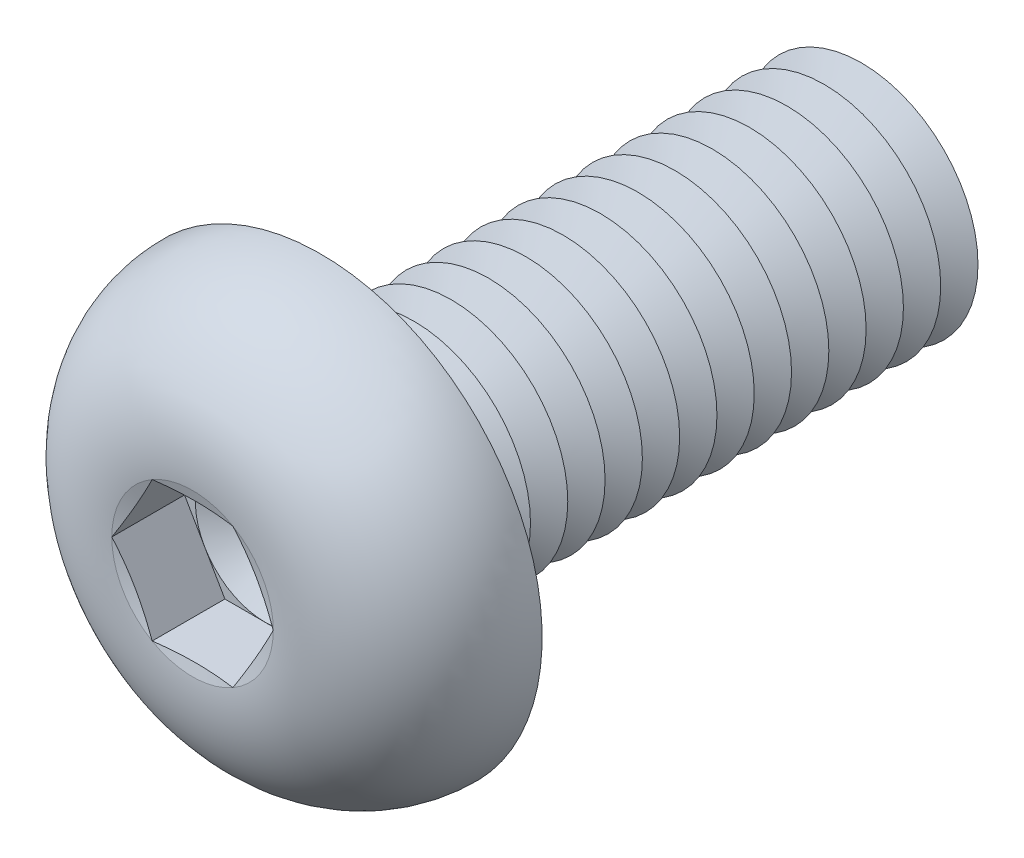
SolidWorks part; units mm, degrees
ref_plane "Front Plane" through (0, 0, 0) normal (0, 0, 1) x (1, 0, 0)
ref_plane "Top Plane" through (0, 0, 0) normal (0, 1, 0) x (1, 0, 0)
ref_plane "Right Plane" through (0, 0, 0) normal (1, 0, 0) x (0, 0, -1)
sketch "Sketch1" plane through (0, 0, 0) normal (1, 0, 0) x (0, 0, -1)
  line L0 (0, 2.5) -> (0, 4.75)
  line L3 (0, 2.5) -> (12, 2.5)
  line L4 (12, 2.5) -> (12, 0)
  line L5 (12, 0) -> (-2.75, 0) construction
  line L6 (-2.75, 0) -> (12, 0)
  line L7 (-2.75, 1.732) -> (-2.75, 0.866) construction
  line L8 (-2.75, 0.866) -> (-2.75, 0)
  line L9 (-2.75, 1.732) -> (-2.5179, 0.866)
  line L10 (-2.5179, 0.866) -> (-2.75, 0.866)
  line L11 (12, 0) -> (22.7481, 0) construction
  line L12 (0, 4.75) -> (-2.75, 4.75) construction
  arc A1 (0, 4.75) -> (-2.75, 1.732) centre (0, 1.9881) ccw
  point P8 (12, 1.25)
  dimension "D1" = 9.5
  dimension "D2" = 5
  dimension "D3" = 2.75
  dimension "D4" = 3.4641
  dimension "D5" = 12
  dimension "D6" = 15
revolve "Revolve1" add sketch "Sketch1" angle 360 about L5
fillet "Fillet1" radius 0.4 1 edges at (-2.5, 0, 0)
sketch "Sketch2" plane through (0, 0, 0) normal (1, 0, 0) x (0, 0, -1)
  line L0 (11.6, 2.5) -> (12.4, 2.5)
  line L1 (12, 2.5) -> (0.4, 2.5) construction
  line L2 (12.4, 2.5) -> (12, 1.8072)
  line L3 (12, -2.5) -> (12, 2.5) construction
  line L4 (12, 1.8072) -> (11.6, 2.5)
  dimension "D1" = 0.8
revolve "Cut-Revolve1" cut sketch "Sketch2" angle 360 about axis through (0, 0, -12) along (0, 0, -1)
pattern_linear "LPattern1" count 15 spacing 0.8 along (0, 0, 1) of "Cut-Revolve1"
sketch "Sketch3" plane through (0, 0, 2.75) normal (0, 0, 1) x (1, 0, 0)
  line L7 (0.866, 1.5) -> (-0.866, 1.5)
  line L8 (-0.866, 1.5) -> (-1.7321, 0)
  line L9 (-1.7321, 0) -> (-0.866, -1.5)
  line L10 (-0.866, -1.5) -> (0.866, -1.5)
  line L11 (0.866, -1.5) -> (1.7321, 0)
  line L12 (1.7321, 0) -> (0.866, 1.5)
  circle A0 centre (0, 0) radius 1.5 construction
  circle A3 centre (0, 0) radius 1.732 construction
extrude "Cut-Extrude1" cut sketch "Sketch3" against normal blind 1.56
sketch "Sketch4" plane through (0, 0, 1.19) normal (0, 0, 1) x (1, 0, 0)
  line L1 (0.866, 1.5) -> (-0.866, 1.5) construction
  circle A0 centre (0, 0) radius 1.5
extrude "Cut-Extrude2" cut sketch "Sketch4" against normal through all draft 60
